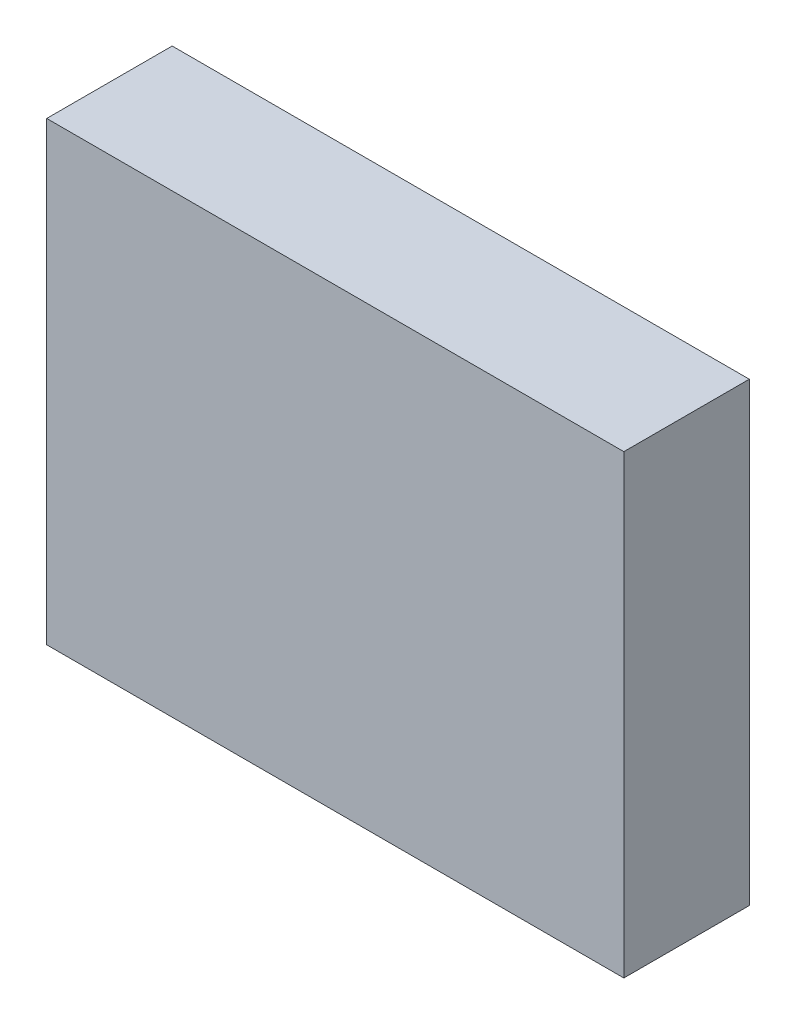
SolidWorks part; units mm, degrees
ref_plane "Plan de face" through (0, 0, 0) normal (0, 0, 1) x (1, 0, 0)
ref_plane "Plan de dessus" through (0, 0, 0) normal (0, 1, 0) x (1, 0, 0)
ref_plane "Plan de droite" through (0, 0, 0) normal (1, 0, 0) x (0, 0, -1)
sketch "Esquisse1" plane through (0, 0, 0) normal (0, 0, 1) x (1, 0, 0)
  line L1 (-57.4017, 42.1997) -> (80.5983, 42.1997)
  line L2 (-57.4017, 42.1997) -> (-57.4017, -66.8003)
  line L3 (-57.4017, -66.8003) -> (80.5983, -66.8003)
  line L4 (80.5983, 42.1997) -> (80.5983, -66.8003)
  dimension "D1" = 138
  dimension "D2" = 109
extrude "Boss.-Extru.1" add sketch "Esquisse1" along normal blind 30
